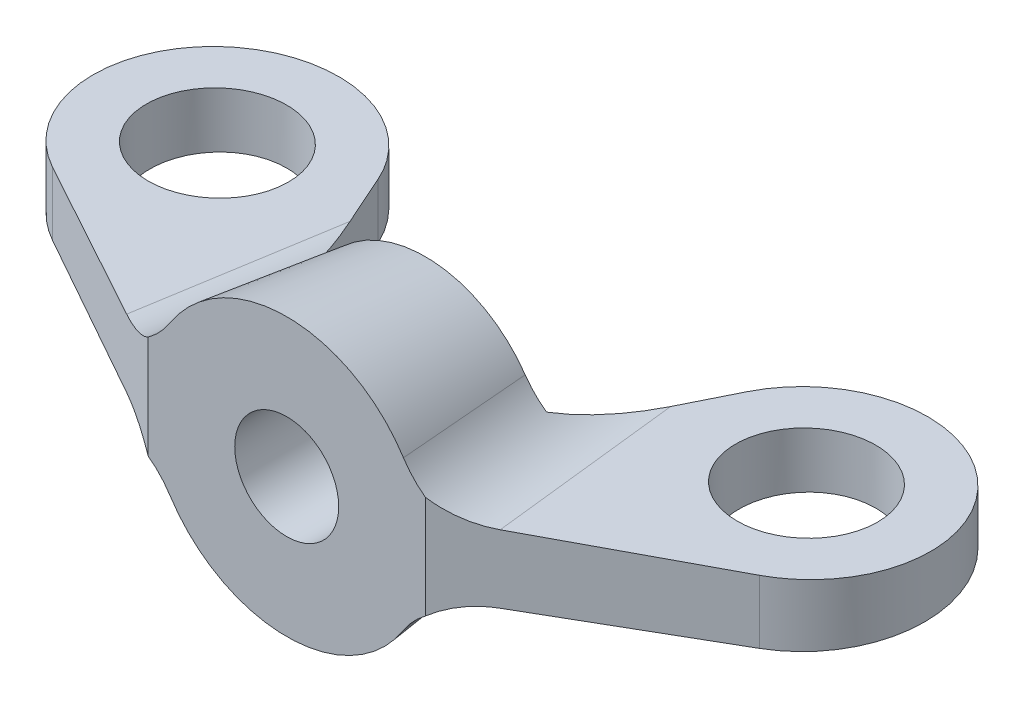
SolidWorks part; units mm, degrees
ref_plane "Front" through (0, 0, 0) normal (0, 0, 1) x (1, 0, 0)
ref_plane "Top" through (0, 0, 0) normal (0, 1, 0) x (1, 0, 0)
ref_plane "Right" through (0, 0, 0) normal (1, 0, 0) x (0, 0, -1)
sketch "Sketch1" plane through (0, 0, 0) normal (0, 1, 0) x (1, 0, 0)
  line L0 (0, 0) -> (-4, 0)
  line L1 (-4, 0) -> (-3.5, 4)
  line L2 (-3.5, 4) -> (0, 4)
  line L3 (0, 4) -> (0, 0)
  line L4 (0, 81.8931) -> (0, -68.5988) construction
  dimension "dk" = 8
  dimension "m" = 4
  dimension "d" = 7
revolve "BaseNut" add sketch "Sketch1" angle 360 about L4
ref_plane "Plane1" through (0, 0, -10) normal (0, 0, 1) x (1, 0, 0)
sketch "Sketch2" plane through (0, 0, 0) normal (0, 0, 1) x (1, 0, 0)
  line L0 (0, 0) -> (1.301, 0) construction
  line L1 (-12, -1) -> (0, -1)
  line L2 (-12, -1) -> (-12, 1)
  line L3 (-12, 1) -> (0, 1)
  line L4 (0, -1) -> (0, 1)
  dimension "D1" = 2
  dimension "l/2" = 12
sketch "Sketch3" plane through (17.5788, 0, -10) normal (0, 0, 1) x (-1, 0, 0)
  line L0 (14.5626, 0) -> (37.334, 0) construction
  line L1 (17.5788, -0.75) -> (29.5788, -0.75)
  line L2 (17.5788, -0.75) -> (17.5788, 0.75)
  line L3 (17.5788, 0.75) -> (29.5788, 0.75)
  line L4 (29.5788, -0.75) -> (29.5788, 0.75)
  line L5 (29.5788, 1) -> (29.5788, -1) construction
  dimension "y" = 1.5
loft "Loft1" add profiles "Sketch3", "Sketch2"
sketch "Sketch4" plane through (0, 0, 0) normal (0, 1, 0) x (1, 0, 0)
  line L0 (-4, 0) -> (-10.1983, 3.4396)
  line L2 (-3.5, 4) -> (-5.3195, 7.961)
  line L4 (0, 12.3693) -> (0, -0.3633) construction
  line L6 (-3.5, 4) -> (0, 4)
  line L7 (0, 4) -> (0, 11)
  line L8 (-4, 0) -> (-13, 0)
  line L9 (-3.873, 0) -> (-12, 0) construction
  line L10 (0, 11) -> (-13, 11)
  line L11 (-13, 11) -> (-13, 0)
  line L12 (3.5, 4) -> (-3.3823, 4) construction
  line L13 (-3.873, 0) -> (4, 0) construction
  arc A0 (-5.3195, 7.961) -> (-10.1983, 3.4396) centre (-8.5, 6.5) ccw
  dimension "R" = 3.5
  dimension "k" = 10
  dimension "l" = 24
  dimension "dk/2" = 4
  dimension "d/2" = 3.5
  dimension "k+1" = 11
  dimension "L/2+1" = 13
extrude "Cut-Extrude1" cut sketch "Sketch4" against normal through all and the other way through all
fillet "Fillet1" radius 2.5 2 edges
mirror "Mirror1" about plane through (0, 0, 0) normal (1, 0, 0) of "Fillet1", "Cut-Extrude1", "Loft1"
sketch "Sketch5" plane through (1.6375, -0.8948, -4) normal (0, 0, -1) x (-1, 0, 0)
  circle A0 centre (1.6375, 0.8948) radius 1.5
  arc A1 (-1.2448, -1.0908) -> (4.5197, -1.0908) centre (1.6375, 0.8948) ccw construction
  dimension "D" = 3
extrude "Hole1" cut sketch "Sketch5" against normal through all
sketch "Sketch7" plane through (0, 0, 0) normal (0, 1, 0) x (1, 0, 0)
  circle A0 centre (-8.5, 6.5) radius 2
  circle A1 centre (8.5, 6.5) radius 2
  arc A2 (-5.3195, 7.961) -> (-10.1983, 3.4396) centre (-8.5, 6.5) ccw construction
  arc A3 (10.1983, 3.4396) -> (5.3195, 7.961) centre (8.5, 6.5) ccw construction
  dimension "D1" = 4
extrude "Hole2" cut sketch "Sketch7" against normal through all and the other way through all
sketch "Sketch8" plane through (0, 0, 0) normal (0, 1, 0) x (1, 0, 0)
  line L0 (0, 7.8239) -> (0, -2.3836) construction
  line L1 (1.25, 0.125) -> (1.5, 0.125)
  line L2 (1.5, 0.125) -> (1.7165, 0)
  line L3 (1.7165, 0) -> (1.5, -0.125)
  line L4 (1.5, -0.125) -> (1.25, -0.125)
  line L5 (1.25, -0.125) -> (1.25, 0.125)
  line L7 (-1.5, 0) -> (1.5, 0) construction
  dimension "D1" = 0.25
  dimension "D2" = 3
revolve "Cut-Revolve10" [suppressed] cut sketch "Sketch8" angle 360 about L0
pattern_linear "LPattern10" [suppressed] count 13 spacing 0.3 along (0, 0, 1)
equation "\"dk/2@Sketch4\" = \"dk@Sketch1\" / 2"
equation "\"d/2@Sketch4\" = \"d@Sketch1\" / 2"
equation "\"L/2+1@Sketch4\" = \"l@Sketch4\"/2+1"
equation "\"l/2@Sketch2\" = \"l@Sketch4\"/2"
equation "\"k@Sketch4\" = \"k@Plane1\""
equation "\"k+1@Sketch4\" = \"k@Sketch4\"+1"
equation "\"D2@Sketch8\" = \"D@Sketch5\""
equation "\"D1@Sketch8\" = (  \"D2@ThreadCosmetic1\" - \"D@Sketch5\" )  / 2"
equation "\"D1@LPattern10\" = \"m@Sketch1\" / \"D3@LPattern10\""
equation "\"D3@LPattern10\" = \"D1@Sketch8\" * 1.2"
